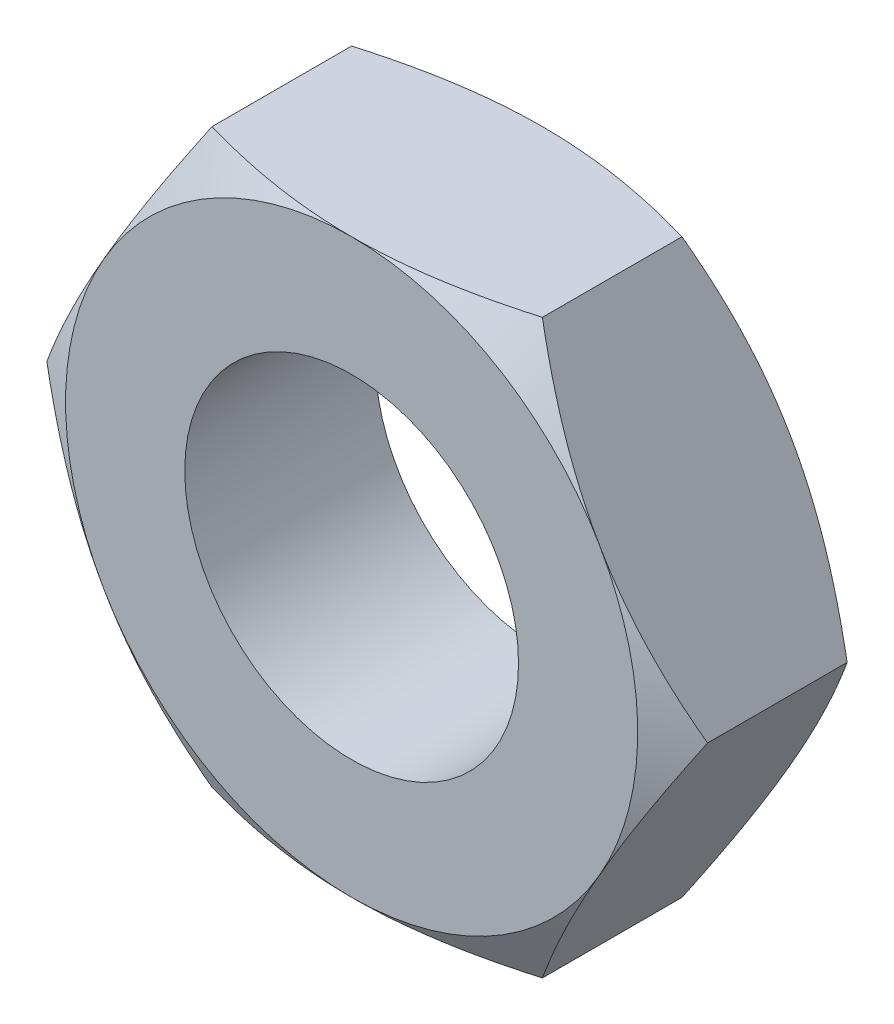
SolidWorks part; units mm, degrees
ref_plane "Front Plane" through (0, 0, 0) normal (0, 0, 1) x (1, 0, 0)
ref_plane "Top Plane" through (0, 0, 0) normal (0, 1, 0) x (1, 0, 0)
ref_plane "Right Plane" through (0, 0, 0) normal (1, 0, 0) x (0, 0, -1)
sketch "Sketch1" plane through (0, 0, 0) normal (0, 0, 1) x (1, 0, 0)
  line L1 (8.6603, 15) -> (-8.6603, 15)
  line L2 (-8.6603, 15) -> (-17.3205, 0)
  line L3 (-17.3205, 0) -> (-8.6603, -15)
  line L4 (-8.6603, -15) -> (8.6603, -15)
  line L5 (8.6603, -15) -> (17.3205, 0)
  line L6 (17.3205, 0) -> (8.6603, 15)
  circle A0 centre (0, 0) radius 15 construction
  dimension "D1" = 30
extrude "Extrude1" add sketch "Sketch1" along normal mid plane 10
sketch "Sketch2" plane through (0, 0, 0) normal (1, 0, 0) x (0, 0, -1)
  line L0 (-5, 15) -> (-5, 30)
  line L1 (-5, 30) -> (3.6603, 30)
  line L2 (3.6603, 30) -> (-5, 15)
  line L3 (0, 0) -> (6.7182, 0) construction
  dimension "D1" = 30
  dimension "D2" = 30
revolve "Cut-Revolve1" cut sketch "Sketch2" angle 360 about L3
mirror "Mirror1" about plane through (0, 0, 0) normal (0, 0, 1) of "Cut-Revolve1"
hole_wizard " Tapped Hole1" positions "Sketch4" profile "Sketch3" tap size "M20" standard "DIN"
sketch "Sketch4" plane through (0, 0, 5) normal (0, 0, 1) x (1, 0, 0)
  point P0 (0, 0)
sketch "Sketch3" plane through (0, 0, 5) normal (1, 0, 0) x (0, -1, 0)
  line L0 (0, 0) -> (0, 10)
  line L1 (0, 10) -> (8.75, 10)
  line L2 (8.75, 10) -> (8.75, 0)
  line L5 (8.75, 0) -> (0, 0)
  line L11 (0, -6.35) -> (0, 107.95) construction
  dimension "Thru Tap Drill Dia." = 17.5
  dimension "Thru Tap Drill Depth" = 10
